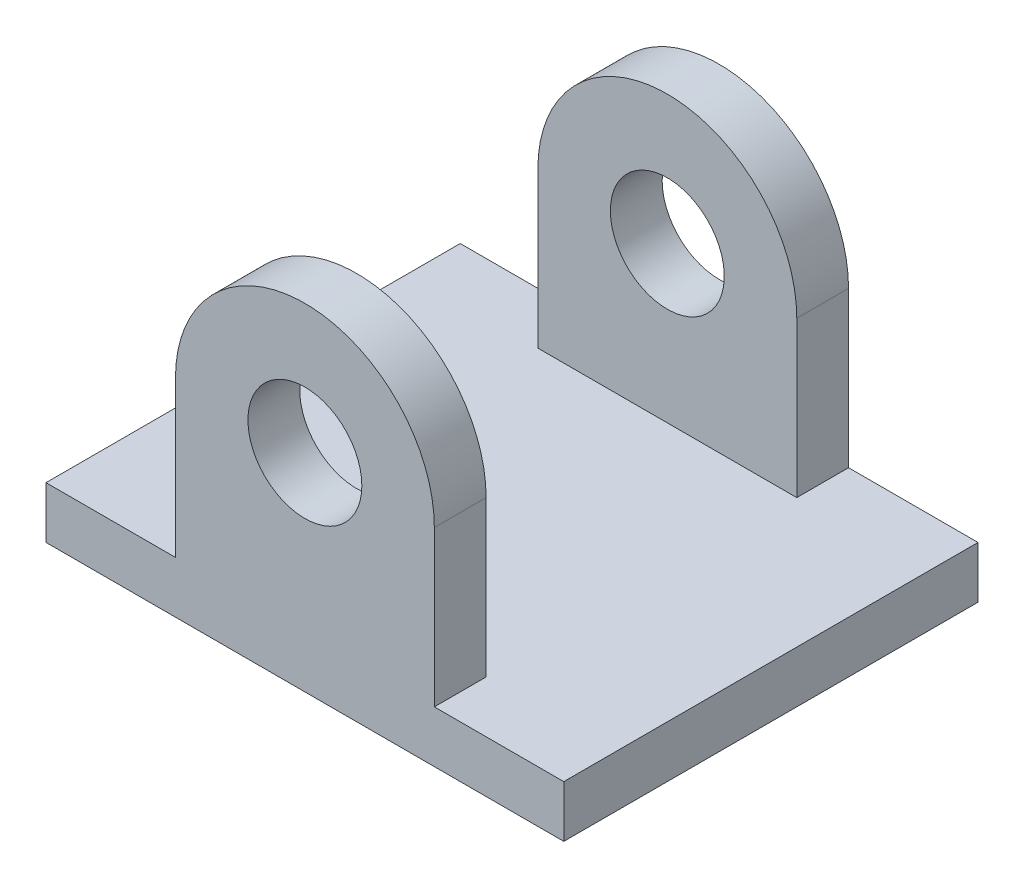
SolidWorks part; units mm, degrees
ref_plane "Front Plane" through (0, 0, 0) normal (0, 0, 1) x (1, 0, 0)
ref_plane "Top Plane" through (0, 0, 0) normal (0, 1, 0) x (1, 0, 0)
ref_plane "Right Plane" through (0, 0, 0) normal (1, 0, 0) x (0, 0, -1)
sketch "Sketch1" plane through (0, 0, 0) normal (0, 1, 0) x (1, 0, 0)
  line L1 (-25, 20) -> (25, 20)
  line L2 (-25, 20) -> (-25, -20)
  line L3 (-25, -20) -> (25, -20)
  line L4 (25, 20) -> (25, -20)
  line L5 (-25, 20) -> (25, -20) construction
  line L6 (-25, -20) -> (25, 20) construction
  point P0 (0, 0)
  dimension "D1" = 40
  dimension "D2" = 50
extrude "Boss-Extrude1" add sketch "Sketch1" along normal blind 5
sketch "Sketch2" plane through (0, 0, 20) normal (0, 0, 1) x (1, 0, 0)
  line L0 (-25, 0) -> (25, 0) construction
  line L1 (-12.5, 0) -> (12.5, 0)
  line L2 (-12.5, 0) -> (-12.5, 20)
  line L3 (-12.5, 20) -> (12.5, 20)
  line L4 (12.5, 0) -> (12.5, 20)
  circle A0 centre (0, 20) radius 12.5
  point P8 (0, 0)
  dimension "D1" = 25
  dimension "D2" = 20
extrude "Boss-Extrude2" add sketch "Sketch2" against normal blind 5 contours L3 A0 | L3 A0 | A0 L2 L4 M8
hole_wizard "Ø11.0 (11) Diameter Hole1" positions "Sketch3" profile "Sketch4" hole size "Ø11.0" standard "ANSI Metric"
sketch "Sketch3" plane through (0, 0, 20) normal (0, 0, 1) x (1, 0, 0)
  point P0 (0, 20)
sketch "Sketch4" plane through (0, 20, 20) normal (1, 0, 0) x (0, -1, 0)
  line L0 (0, 0) -> (0, 40)
  line L1 (0, 40) -> (5.5, 40)
  line L2 (5.5, 40) -> (5.5, 0)
  line L5 (5.5, 0) -> (0, 0)
  line L11 (0, -6.35) -> (0, 107.95) construction
  dimension "Thru Hole Dia." = 11
  dimension "Thru Hole Depth" = 40
mirror "Mirror1" about plane through (0, 0, 0) normal (0, 0, 1) of "Ø11.0 (11) Diameter Hole1", "Boss-Extrude2"
